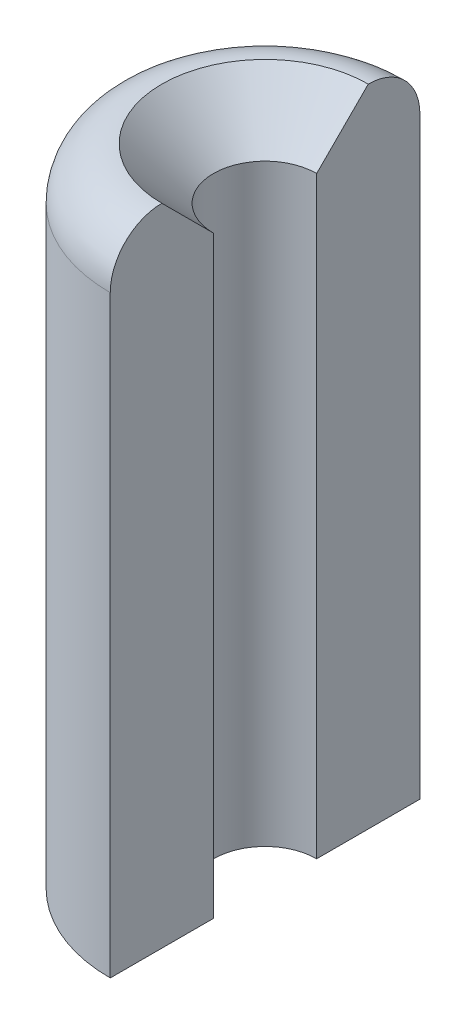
SolidWorks part; units mm, degrees
ref_plane "face" through (0, 0, 0) normal (0, 0, 1) x (1, 0, 0)
ref_plane "dessus" through (0, 0, 0) normal (0, 1, 0) x (1, 0, 0)
ref_plane "profil" through (0, 0, 0) normal (1, 0, 0) x (0, 0, -1)
sketch "Esquisse1" plane through (0, 0, 0) normal (0, 0, 1) x (1, 0, 0)
  line L0 (14, 0) -> (14, 5.5)
  line L1 (2, 0) -> (2, 5.5)
  line L2 (0, 0) -> (0, 5.5)
  line L3 (0, 0) -> (2, 0)
  line L4 (16, 0) -> (16, 5.5)
  line L5 (14, 0) -> (16, 0)
  arc A0 (0, 5.5) -> (16, 5.5) centre (8, 5.5) cw
  arc A1 (2, 5.5) -> (14, 5.5) centre (8, 5.5) cw
  dimension "D4" = 2
  dimension "D3" = 5.5
  dimension "D1" = 16
  dimension "D2" = 5.5
extrude "Base-Extrusion" add sketch "Esquisse1" against normal blind 10
sketch "Esquisse10" plane through (0, 0, 0) normal (0, -1, 0) x (1, 0, 0)
  line L0 (14, 0) -> (2, 0) construction
  line L1 (2, -10) -> (2, 0) construction
  circle A0 centre (-1.5, -5) radius 3
  dimension "D1" = 6
  dimension "D2" = 5
  dimension "D3" = 3.5
extrude "Boss.-Extru.5" add sketch "Esquisse10" against normal blind 12.5
ref_plane "Plan1" through (-1.5, 0, 0) normal (1, 0, 0) x (0, 0, -1)
sketch "Esquisse4" plane through (-1.5, 0, 0) normal (1, 0, 0) x (0, 0, -1)
  line L0 (10, 5.5) -> (10, 0) construction
  line L1 (8, 0) -> (2, 0)
  line L2 (8, 0) -> (8, 11.5)
  line L3 (8, 11.5) -> (2, 11.5)
  line L4 (2, 0) -> (2, 11.5)
  dimension "D1" = 11.5
  dimension "D2" = 6
  dimension "D3" = 2
extrude "Boss.-Extru.3" add sketch "Esquisse4" along normal up to next
ref_plane "Plan2" through (0, 0, -5) normal (0, 0, 1) x (1, 0, 0)
fillet "Congé3" radius 1
hole_wizard "Perçage1" positions "Esquisse12" profile "Esquisse11" countersink size "M2" standard "Ansi Métrique"
sketch "Esquisse12" plane through (0, 12.5, 0) normal (0, 1, 0) x (-1, 0, 0)
  point P0 (1.5, -5)
sketch "Esquisse11" plane through (-1.5, 12.5, -5) normal (1, 0, 0) x (0, 0, 1)
  line L0 (0, 0) -> (0, 12.5)
  line L1 (0, 12.5) -> (1, 12.5)
  line L2 (1, 12.5) -> (1, 1)
  line L3 (1, 1) -> (2, 0)
  line L5 (2, 0) -> (0, 0)
  line L6 (-1, 1) -> (-2, 0) construction
  line L11 (0, -6.35) -> (0, 107.95) construction
  dimension "Diamètre du perçage jusqu'au prochain" = 2
  dimension "Profondeur du perçage jusqu'au prochain" = 12.5
  dimension "Diamètre du fraisage entrant" = 4
  dimension "Angle du fraisage entrant" = 90
sketch "Esquisse9" plane through (0, 0, -5) normal (0, 0, 1) x (1, 0, 0)
  line L4 (2, 0) -> (2, 5.5) construction
  line L6 (2, 2.1191) -> (2, 1.1191)
  arc A0 (2, 1.1191) -> (2, 2.1191) centre (2, 1.6191) ccw
  dimension "D1" = 1
extrude "Boss.-Extru.4" add sketch "Esquisse9" along normal mid plane 8
fillet "Congé5" radius 0.5
ref_plane "Plan3" through (8, 0, 0) normal (-1, 0, 0) x (0, 0, 1)
mirror "Symétrie1" about plane through (8, 0, 0) normal (-1, 0, 0)
sketch "Esquisse13" plane through (-1.5, 0, 0) normal (1, 0, 0) x (0, 0, -1)
  line L1 (-1.2699, 0) -> (11.2699, 0)
  line L2 (-1.2699, 0) -> (-1.2699, 14.299)
  line L3 (-1.2699, 14.299) -> (11.2699, 14.299)
  line L4 (11.2699, 0) -> (11.2699, 14.299)
extrude "Enlèv. mat.-Extru.1" cut sketch "Esquisse13" along normal up to next
